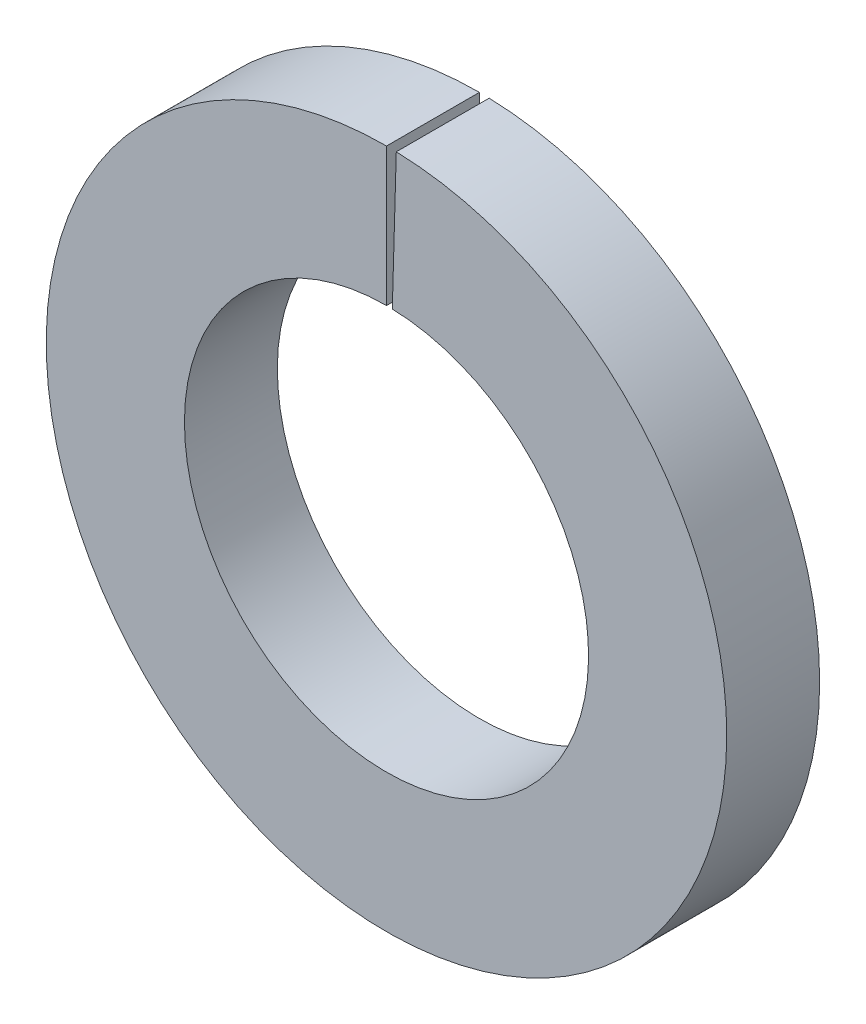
SolidWorks part; units mm, degrees
ref_plane "Plane1" through (0, 0, 0) normal (0, 0, 1) x (1, 0, 0)
ref_plane "Plane2" through (0, 0, 0) normal (0, 1, 0) x (1, 0, 0)
ref_plane "Plane3" through (0, 0, 0) normal (1, 0, 0) x (0, 0, -1)
sketch "Sketch1" plane through (0, 0, 0) normal (0, 0, 1) x (1, 0, 0)
  circle A0 centre (0, 0) radius 3.7211
  circle A1 centre (0, 0) radius 2.2098
  dimension "O.D." = 7.4422
  dimension "I.D." = 4.4196
extrude "Washer" add sketch "Sketch1" along normal blind 1.016
sketch "Sketch2" plane through (0, 0, 0) normal (0, 0, -1) x (-1, 0, 0)
  line L0 (0, 2.2098) -> (0, 3.7211)
  line L1 (-0.0635, 2.2089) -> (-0.1069, 3.7196)
  line L2 (0, 0) -> (0, 3.7211) construction
  line L3 (0, 0) -> (-0.1069, 3.7196) construction
  circle A0 centre (0, 0) radius 2.2098 construction
  circle A1 centre (0, 0) radius 3.7211 construction
  arc A2 (0, 2.2098) -> (-0.0635, 2.2089) centre (0, 0) ccw
  arc A3 (0, 3.7211) -> (-0.1069, 3.7196) centre (0, 0) ccw
  dimension "D1" = 0.0635
extrude "Cut-Extrude1" cut sketch "Sketch2" against normal through all
